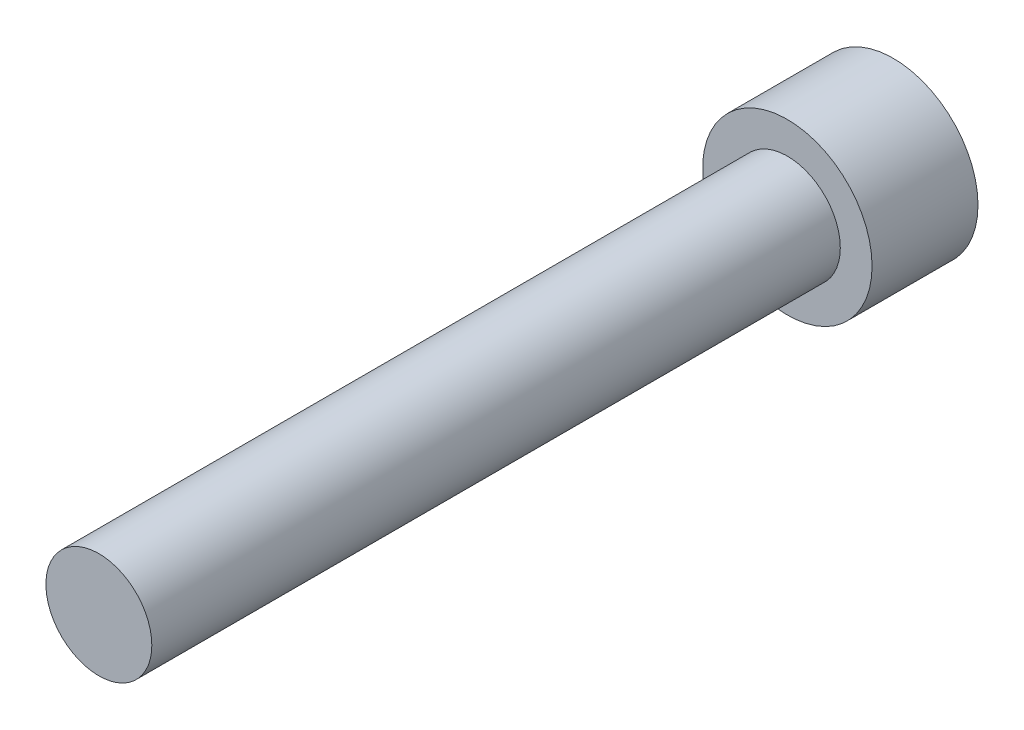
SolidWorks part; units mm, degrees
ref_plane "Front Plane" through (0, 0, 0) normal (0, 0, 1) x (1, 0, 0)
ref_plane "Top Plane" through (0, 0, 0) normal (0, 1, 0) x (1, 0, 0)
ref_plane "Right Plane" through (0, 0, 0) normal (1, 0, 0) x (0, 0, -1)
sketch "Sketch6" plane through (0, 0, 0) normal (1, 0, 0) x (0, 0, -1)
  line L0 (-65, 0) -> (22.525, 0) construction
  line L1 (8.8, 0) -> (-8.8, 0) construction
  line L2 (-65, 0) -> (-65, -5)
  line L3 (-65, -5) -> (0, -5)
  line L4 (0, 8.8) -> (0, -8.8) construction
  line L5 (0, -5) -> (0, -8)
  line L6 (0, -8) -> (10, -8)
  line L7 (10, -8) -> (10, 0)
  line L8 (10, 0) -> (-65, 0)
  dimension "L" = 65
  dimension "H" = 10
  dimension "A" = 16
  dimension "D" = 10
revolve "Revolve1" add sketch "Sketch6" angle 360 about L0
sketch "Sketch7" plane through (0, 0, -10) normal (0, 0, -1) x (-1, 0, 0)
  line L2 (-4, 2.3094) -> (-4, -2.3094)
  line L4 (-4, -2.3094) -> (0, -4.6188)
  line L5 (0, -4.6188) -> (4, -2.3094)
  line L6 (4, -2.3094) -> (4, 2.3094)
  line L7 (4, 2.3094) -> (0, 4.6188)
  line L8 (0, 4.6188) -> (-4, 2.3094)
  circle A0 centre (0, 0) radius 4 construction
  dimension "J" = 8
extrude "HEX" cut sketch "Sketch7" against normal blind 8
